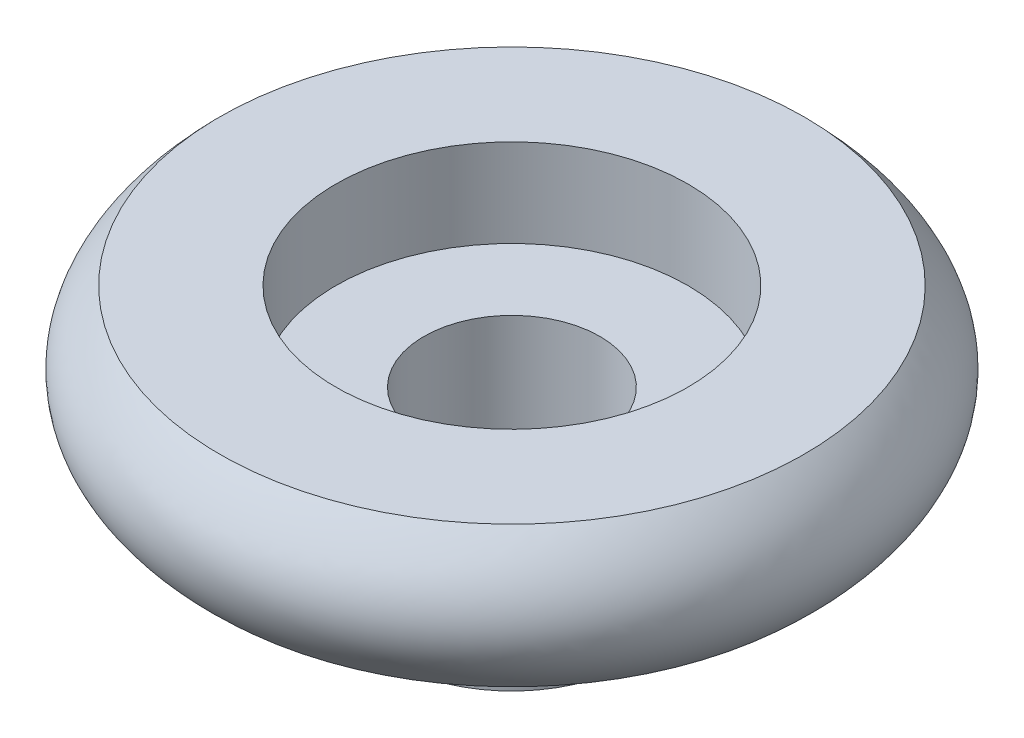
SolidWorks part; units mm, degrees
ref_plane "Front Plane" through (0, 0, 0) normal (0, 0, 1) x (1, 0, 0)
ref_plane "Top Plane" through (0, 0, 0) normal (0, 1, 0) x (1, 0, 0)
ref_plane "Right Plane" through (0, 0, 0) normal (1, 0, 0) x (0, 0, -1)
sketch "Sketch1" plane through (0, 0, 0) normal (0, 0, 1) x (1, 0, 0)
  line L0 (0, 0) -> (0, 28.4201) construction
  line L1 (3.5, 0.4424) -> (3.5, 3.4424)
  line L3 (8.3, 7.9424) -> (5, 7.9424)
  line L4 (5, 7.9424) -> (5, 5.4424)
  line L5 (5, 5.4424) -> (2.5, 5.4424)
  line L6 (2.5, 5.4424) -> (2.5, 0.4424)
  line L7 (2.5, 0.4424) -> (3.5, 0.4424)
  line L8 (8.3, 3.9424) -> (8.3, 4.4424)
  line L9 (8.3, 4.4424) -> (5, 4.4424)
  line L11 (5, 4.4424) -> (5, 3.4424)
  line L12 (5, 3.4424) -> (3.5, 3.4424)
  line L13 (0, 5.6794) -> (9.35, 5.6794) construction
  spline S0 degree 2 poles (8.3, 7.9424) (10.4224, 5.8263) (8.3, 3.9424) knots 0 0 0 1 1 1
  point P12 (0, 0)
  dimension "D9" = 9.35
  dimension "D10" = 4
  dimension "D11" = 1
  dimension "D1" = 3.3
  dimension "D2" = 5
  dimension "D3" = 3.3
  dimension "D4" = 3.5
  dimension "D5" = 2.5
  dimension "D6" = 5
  dimension "D7" = 2.5
  dimension "D8" = 1.5
  dimension "D12" = 1
revolve "Revolve1" add sketch "Sketch1" angle 360 about L0
